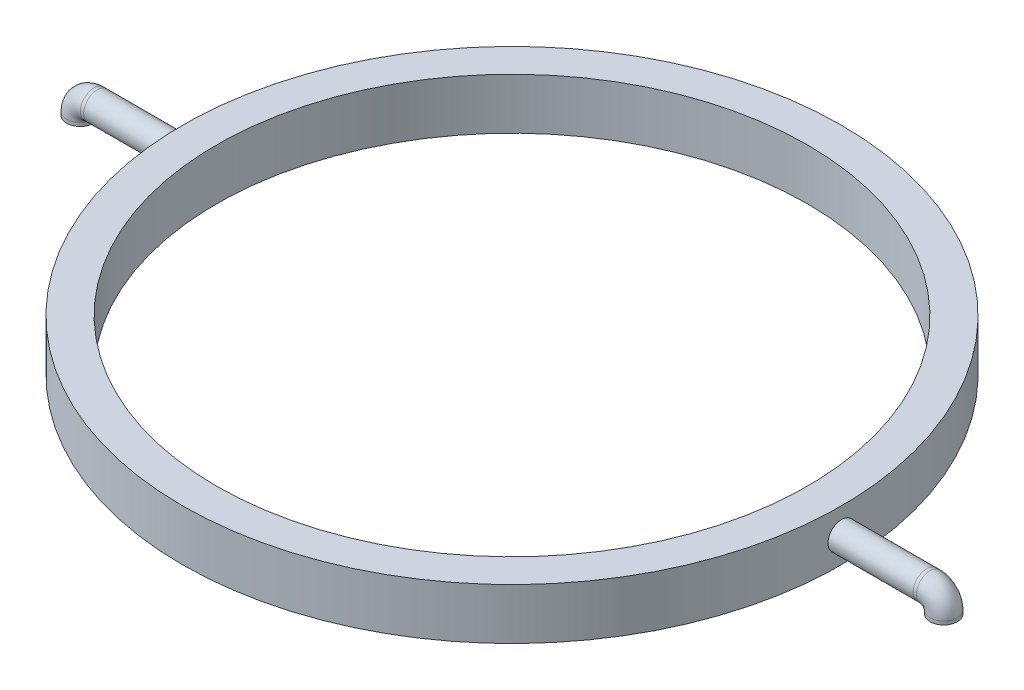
SolidWorks part; units mm, degrees
ref_plane "Front Plane" through (0, 0, 0) normal (0, 0, 1) x (1, 0, 0)
ref_plane "Top Plane" through (0, 0, 0) normal (0, 1, 0) x (1, 0, 0)
ref_plane "Right Plane" through (0, 0, 0) normal (1, 0, 0) x (0, 0, -1)
sketch "Sketch2" plane through (0, 0, 0) normal (0, 0, 1) x (1, 0, 0)
  line L0 (0, 0) -> (0, 86.7659)
  line L1 (86.8, 0) -> (86.8, 15)
  line L2 (86.8, 15) -> (96.8, 15)
  line L3 (96.8, 15) -> (96.8, 0)
  line L4 (86.8, 0) -> (96.8, 0)
revolve "Revolve1" add sketch "Sketch2" angle 360 about L0
sketch "Sketch4"
  dimension "D1" = 4
ref_plane "Plane1" through (96.8, 0, 0) normal (1, 0, 0) x (0, 0, -1)
sketch "Sketch5" plane through (96.8, 0, 0) normal (1, 0, 0) x (0, 0, -1)
  circle A0 centre (0, 7.5) radius 4
sweep "Sweep1" add profiles "Sketch5" path "Sketch4"
mirror "Mirror1" about plane through (0, 0, 0) normal (1, 0, 0)
